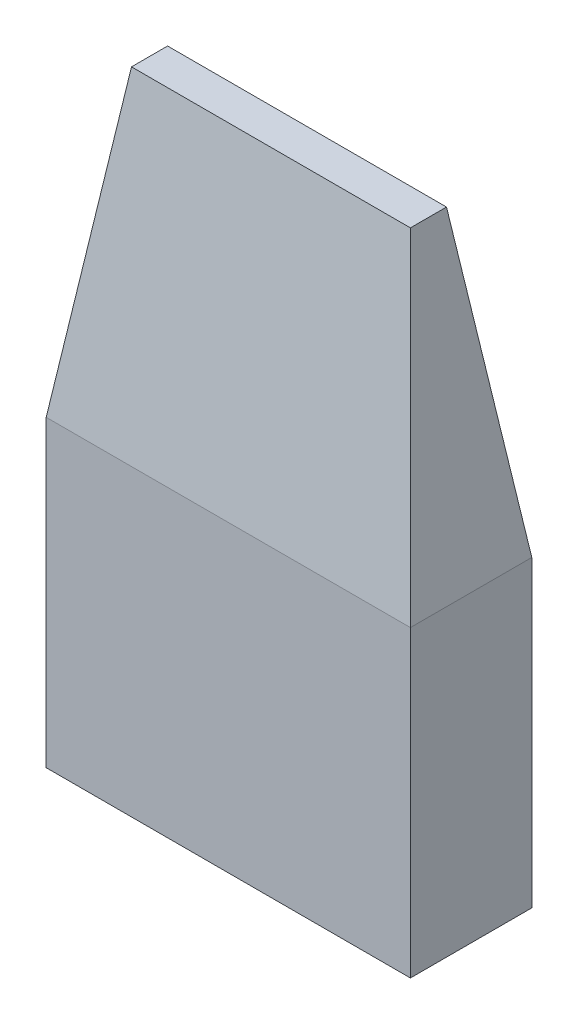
SolidWorks part; units mm, degrees
ref_plane "Front Plane" through (0, 0, 0) normal (0, 0, 1) x (1, 0, 0)
ref_plane "Top Plane" through (0, 0, 0) normal (0, 1, 0) x (1, 0, 0)
ref_plane "Right Plane" through (0, 0, 0) normal (1, 0, 0) x (0, 0, -1)
sketch "Sketch1" plane through (0, 0, 0) normal (0, 0, 1) x (1, 0, 0)
  line L1 (-30, 50) -> (30, 50)
  line L2 (-30, 50) -> (-30, -50)
  line L3 (-30, -50) -> (30, -50)
  line L4 (30, 50) -> (30, -50)
  dimension "D1" = 100
  dimension "D2" = 60
  dimension "D3" = 30
  dimension "D4" = 50
extrude "Extrude1" add sketch "Sketch1" along normal mid plane 20
draft "Draft1" draft angle 8 parameters "D1"=8
